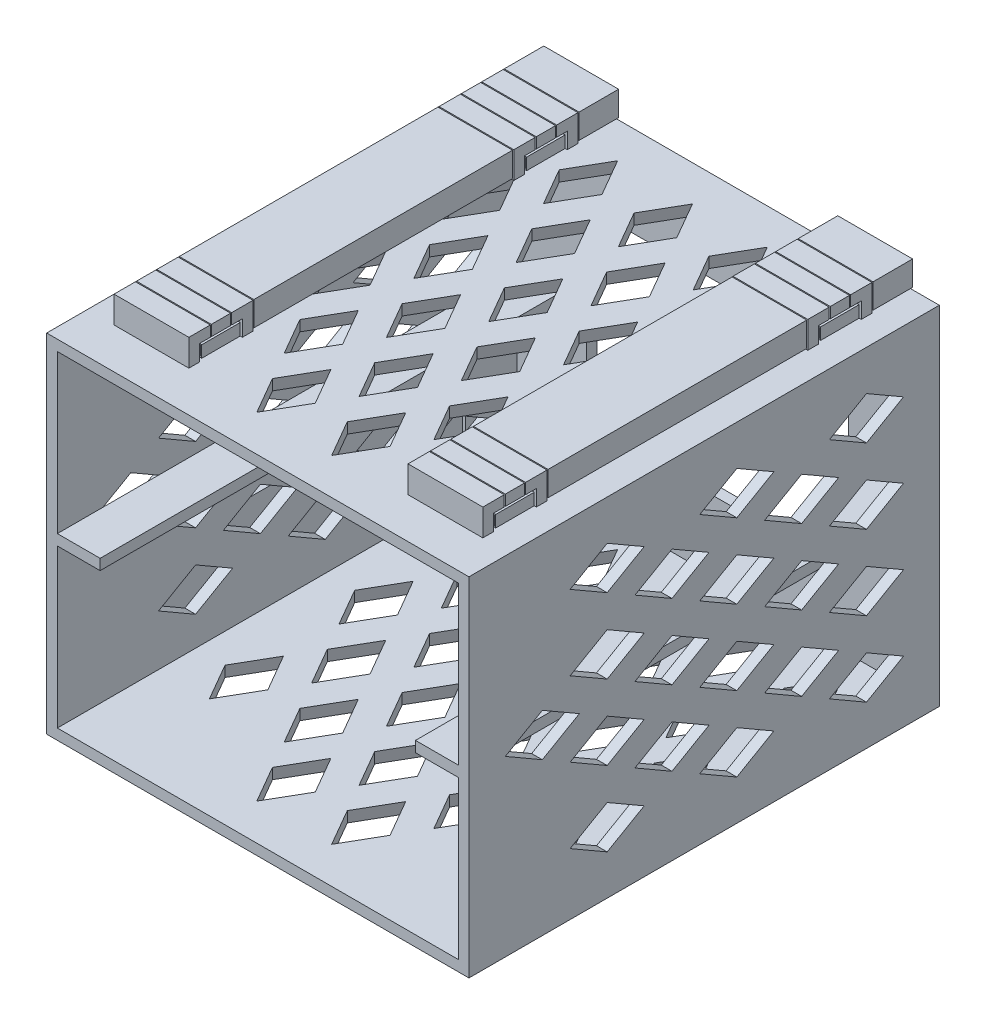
SolidWorks part; units mm, degrees
ref_plane "Alzado" through (0, 0, 0) normal (0, 0, 1) x (1, 0, 0)
ref_plane "Planta" through (0, 0, 0) normal (0, 1, 0) x (1, 0, 0)
ref_plane "Vista lateral" through (0, 0, 0) normal (1, 0, 0) x (0, 0, -1)
sketch "Croquis1" plane through (0, 0, 0) normal (0, 0, -1) x (-1, 0, 0)
  line L1 (-39.5, 32.5) -> (39.5, 32.5)
  line L2 (-39.5, 32.5) -> (-39.5, -32.5)
  line L3 (-39.5, -32.5) -> (39.5, -32.5)
  line L4 (39.5, 32.5) -> (39.5, -32.5)
  line L7 (-24.5, 17.5) -> (24.5, 17.5)
  line L8 (-24.5, 17.5) -> (-24.5, -17.5)
  line L9 (-24.5, -17.5) -> (24.5, -17.5)
  line L10 (24.5, 17.5) -> (24.5, -17.5)
extrude "Fondo" add sketch "Croquis1" against normal blind 2 separate body
sketch "Croquis3" plane through (0, 0, 2) normal (0, 0, 1) x (1, 0, 0)
  line L1 (-39.5, 32.5) -> (39.5, 32.5)
  line L2 (-39.5, 32.5) -> (-39.5, -32.5)
  line L3 (-39.5, -32.5) -> (39.5, -32.5)
  line L4 (39.5, 32.5) -> (39.5, -32.5)
  line L6 (-37.5, 30.5) -> (-37.5, -30.5)
  line L7 (-37.5, 30.5) -> (37.5, 30.5)
  line L8 (37.5, 30.5) -> (37.5, -30.5)
  line L9 (-37.5, -30.5) -> (37.5, -30.5)
extrude "Estructura" add sketch "Croquis3" along normal blind 86
sketch "Croquis5" plane through (-39.5, 0, 0) normal (-1, 0, 0) x (0, 0, 1)
  line L0 (13.628, 25) -> (20.556, 21)
  line L1 (20.556, 21) -> (13.628, 17)
  line L2 (13.628, 17) -> (6.7, 21)
  line L3 (6.7, 21) -> (13.628, 25)
  line L4 (0, -32.5) -> (0, 32.5) construction
  line L5 (88, 32.5) -> (0, 32.5) construction
  line L6 (13.628, 11) -> (20.556, 7)
  line L7 (6.7, 7) -> (13.628, 11)
  line L8 (13.628, 3) -> (6.7, 7)
  line L9 (20.556, 7) -> (13.628, 3)
  line L10 (13.628, -3) -> (20.556, -7)
  line L11 (6.7, -7) -> (13.628, -3)
  line L12 (13.628, -11) -> (6.7, -7)
  line L13 (20.556, -7) -> (13.628, -11)
  line L14 (13.628, -17) -> (20.556, -21)
  line L15 (6.7, -21) -> (13.628, -17)
  line L16 (13.628, -25) -> (6.7, -21)
  line L17 (20.556, -21) -> (13.628, -25)
  line L18 (37.884, 25) -> (44.812, 21)
  line L19 (44.812, 21) -> (37.884, 17)
  line L20 (37.884, 17) -> (30.956, 21)
  line L21 (30.956, 21) -> (37.884, 25)
  line L22 (44.812, 7) -> (37.884, 3)
  line L23 (37.884, 11) -> (44.812, 7)
  line L24 (30.956, 7) -> (37.884, 11)
  line L25 (37.884, 3) -> (30.956, 7)
  line L26 (44.812, -7) -> (37.884, -11)
  line L27 (37.884, -3) -> (44.812, -7)
  line L28 (30.956, -7) -> (37.884, -3)
  line L29 (37.884, -11) -> (30.956, -7)
  line L30 (37.884, -17) -> (44.812, -21)
  line L31 (44.812, -21) -> (37.884, -25)
  line L32 (37.884, -25) -> (30.956, -21)
  line L33 (30.956, -21) -> (37.884, -17)
  line L34 (62.14, 25) -> (69.068, 21)
  line L35 (69.068, 21) -> (62.14, 17)
  line L36 (62.14, 17) -> (55.212, 21)
  line L37 (55.212, 21) -> (62.14, 25)
  line L38 (69.068, 7) -> (62.14, 3)
  line L39 (62.14, 11) -> (69.068, 7)
  line L40 (55.212, 7) -> (62.14, 11)
  line L41 (62.14, 3) -> (55.212, 7)
  line L42 (69.068, -7) -> (62.14, -11)
  line L43 (62.14, -3) -> (69.068, -7)
  line L44 (55.212, -7) -> (62.14, -3)
  line L45 (62.14, -11) -> (55.212, -7)
  line L46 (62.14, -17) -> (69.068, -21)
  line L47 (69.068, -21) -> (62.14, -25)
  line L48 (62.14, -25) -> (55.212, -21)
  line L49 (55.212, -21) -> (62.14, -17)
  line L66 (50.012, 18) -> (56.94, 14)
  line L67 (56.94, 14) -> (50.012, 10)
  line L68 (50.012, 10) -> (43.084, 14)
  line L69 (43.084, 14) -> (50.012, 18)
  line L70 (50.012, 4) -> (56.94, 0)
  line L71 (43.084, 0) -> (50.012, 4)
  line L72 (50.012, -4) -> (43.084, 0)
  line L73 (56.94, -14) -> (50.012, -18)
  line L74 (50.012, -10) -> (56.94, -14)
  line L75 (43.084, -14) -> (50.012, -10)
  line L76 (18.828, 14) -> (25.756, 18)
  line L77 (67.34, 14) -> (74.268, 18) construction
  line L78 (67.34, -14) -> (74.268, -10) construction
  line L79 (74.268, -18) -> (67.34, -14) construction
  line L80 (25.756, 4) -> (32.684, 0)
  line L81 (18.828, 0) -> (25.756, 4)
  line L82 (25.756, -4) -> (18.828, 0)
  line L83 (32.684, 0) -> (25.756, -4)
  line L84 (25.756, -18) -> (18.828, -14)
  line L85 (32.684, -14) -> (25.756, -18)
  line L86 (56.94, 0) -> (50.012, -4)
  line L87 (50.012, -18) -> (43.084, -14)
  line L88 (32.684, 14) -> (25.756, 10)
  line L89 (25.756, 10) -> (18.828, 14)
  line L90 (25.756, 18) -> (32.684, 14)
  line L91 (74.268, 18) -> (81.196, 14) construction
  line L92 (81.196, 14) -> (74.268, 10) construction
  line L93 (74.268, 10) -> (67.34, 14) construction
  line L94 (81.196, 0) -> (74.268, -4)
  line L95 (74.268, 4) -> (81.196, 0)
  line L96 (67.34, 0) -> (74.268, 4)
  line L97 (74.268, -4) -> (67.34, 0)
  line L98 (81.196, -14) -> (74.268, -18) construction
  line L99 (74.268, -10) -> (81.196, -14) construction
  line L100 (25.756, -10) -> (32.684, -14)
  line L101 (18.828, -14) -> (25.756, -10)
  line L102 (88, 32.5) -> (0, 32.5) construction
  line L103 (86.396, 25) -> (93.324, 21)
  line L104 (93.324, 21) -> (86.396, 17)
  line L105 (86.396, 17) -> (79.468, 21)
  line L106 (79.468, 21) -> (86.396, 25)
  line L107 (93.324, 7) -> (86.396, 3)
  line L108 (86.396, 11) -> (93.324, 7)
  line L109 (79.468, 7) -> (86.396, 11)
  line L110 (86.396, 3) -> (79.468, 7)
  line L111 (93.324, -7) -> (86.396, -11)
  line L112 (86.396, -3) -> (93.324, -7)
  line L113 (79.468, -7) -> (86.396, -3)
  line L114 (86.396, -11) -> (79.468, -7)
  line L115 (86.396, -17) -> (93.324, -21)
  line L116 (93.324, -21) -> (86.396, -25)
  line L117 (86.396, -25) -> (79.468, -21)
  line L118 (79.468, -21) -> (86.396, -17)
  dimension "D1" = 7.9998
  dimension "D2" = 7.9998
  dimension "D3" = 6.7
  dimension "D4" = 7.5
  dimension "D5" = 8
  dimension "D7" = 13.856
  dimension "D9" = 24.256
  dimension "D10" = 14.5
  dimension "D11" = 24.256
  dimension "D6" = 4
  dimension "D8" = 4
extrude "RombosHor" cut sketch "Croquis5" against normal up to surface (79 mm away)
sketch "Croquis9" plane through (0, 32.5, 0) normal (0, 1, 0) x (1, 0, 0)
  line L0 (28, -6.6872) -> (24, -13.6154)
  line L1 (28, -6.6872) -> (32, -13.6154)
  line L2 (24, -13.6154) -> (28, -20.5436)
  line L3 (32, -13.6154) -> (28, -20.5436)
  line L4 (14, -6.6872) -> (10, -13.6154)
  line L5 (14, -6.6872) -> (18, -13.6154)
  line L6 (18, -13.6154) -> (14, -20.5436)
  line L7 (10, -13.6154) -> (14, -20.5436)
  line L8 (0, -6.6872) -> (-4, -13.6154)
  line L9 (0, -6.6872) -> (4, -13.6154)
  line L10 (4, -13.6154) -> (0, -20.5436)
  line L11 (-4, -13.6154) -> (0, -20.5436)
  line L12 (-14, -6.6872) -> (-18, -13.6154)
  line L13 (-14, -6.6872) -> (-10, -13.6154)
  line L14 (-10, -13.6154) -> (-14, -20.5436)
  line L15 (-18, -13.6154) -> (-14, -20.5436)
  line L16 (-28, -6.6872) -> (-32, -13.6154)
  line L17 (-28, -6.6872) -> (-24, -13.6154)
  line L18 (-24, -13.6154) -> (-28, -20.5436)
  line L19 (-32, -13.6154) -> (-28, -20.5436)
  line L20 (14, -30.9436) -> (10, -37.8718)
  line L21 (14, -30.9436) -> (18, -37.8718)
  line L22 (18, -37.8718) -> (14, -44.8)
  line L23 (10, -37.8718) -> (14, -44.8)
  line L24 (0, -30.9436) -> (-4, -37.8718)
  line L25 (0, -30.9436) -> (4, -37.8718)
  line L26 (4, -37.8718) -> (0, -44.8)
  line L27 (-4, -37.8718) -> (0, -44.8)
  line L28 (-14, -30.9436) -> (-18, -37.8718)
  line L29 (-14, -30.9436) -> (-10, -37.8718)
  line L30 (-10, -37.8718) -> (-14, -44.8)
  line L31 (-18, -37.8718) -> (-14, -44.8)
  line L32 (-28, -30.9436) -> (-32, -37.8718)
  line L33 (-28, -30.9436) -> (-24, -37.8718)
  line L34 (-24, -37.8718) -> (-28, -44.8)
  line L35 (-32, -37.8718) -> (-28, -44.8)
  line L36 (14, -55.2) -> (10, -62.1282)
  line L37 (14, -55.2) -> (18, -62.1282)
  line L38 (18, -62.1282) -> (14, -69.0564)
  line L39 (10, -62.1282) -> (14, -69.0564)
  line L40 (0, -55.2) -> (-4, -62.1282)
  line L41 (0, -55.2) -> (4, -62.1282)
  line L42 (4, -62.1282) -> (0, -69.0564)
  line L43 (-4, -62.1282) -> (0, -69.0564)
  line L44 (-14, -55.2) -> (-18, -62.1282)
  line L45 (-14, -55.2) -> (-10, -62.1282)
  line L46 (-10, -62.1282) -> (-14, -69.0564)
  line L47 (-18, -62.1282) -> (-14, -69.0564)
  line L48 (-28, -55.2) -> (-32, -62.1282)
  line L49 (-28, -55.2) -> (-24, -62.1282)
  line L50 (-24, -62.1282) -> (-28, -69.0564)
  line L51 (-32, -62.1282) -> (-28, -69.0564)
  line L68 (28, -30.9436) -> (24, -37.8718)
  line L69 (28, -30.9436) -> (32, -37.8718)
  line L70 (32, -37.8718) -> (28, -44.8)
  line L71 (24, -37.8718) -> (28, -44.8)
  line L72 (28, -55.2) -> (24, -62.1282)
  line L73 (28, -55.2) -> (32, -62.1282)
  line L74 (32, -62.1282) -> (28, -69.0564)
  line L75 (24, -62.1282) -> (28, -69.0564)
  line L80 (28, -6.6872) -> (14, -6.6872) construction
  line L81 (28, -6.6872) -> (28, -30.9436) construction
  line L83 (39.5, -88) -> (39.5, 0) construction
  line L87 (-39.5, 0) -> (39.5, 0) construction
  line L88 (17, -50.0018) -> (21, -56.93)
  line L89 (7, -67.33) -> (11, -74.2582)
  line L90 (-7, -67.33) -> (-11, -74.2582)
  line L91 (-7, -67.33) -> (-3, -74.2582)
  line L92 (-3, -74.2582) -> (-7, -81.1864)
  line L93 (-21, -67.33) -> (-25, -74.2582) construction
  line L94 (-21, -67.33) -> (-17, -74.2582) construction
  line L95 (-25, -74.2582) -> (-21, -81.1864) construction
  line L96 (21, -67.33) -> (25, -74.2582) construction
  line L97 (25, -74.2582) -> (21, -81.1864) construction
  line L98 (17, -74.2582) -> (21, -81.1864) construction
  line L99 (7, -18.8172) -> (3, -25.7454)
  line L100 (17, -25.7454) -> (21, -32.6736)
  line L101 (21, -18.8172) -> (25, -25.7454)
  line L102 (-7, -43.0736) -> (-11, -50.0018)
  line L103 (-3, -50.0018) -> (-7, -56.93)
  line L104 (-21, -43.0736) -> (-25, -50.0018)
  line L105 (-21, -43.0736) -> (-17, -50.0018)
  line L106 (-3, -25.7454) -> (-7, -32.6736)
  line L107 (-11, -25.7454) -> (-7, -32.6736)
  line L108 (-21, -18.8172) -> (-17, -25.7454)
  line L109 (-21, -18.8172) -> (-25, -25.7454)
  line L110 (-25, -25.7454) -> (-21, -32.6736)
  line L111 (21, -43.0736) -> (17, -50.0018)
  line L112 (11, -25.7454) -> (7, -32.6736)
  line L113 (7, -18.8172) -> (11, -25.7454)
  line L114 (7, -67.33) -> (3, -74.2582)
  line L115 (11, -74.2582) -> (7, -81.1864)
  line L116 (3, -74.2582) -> (7, -81.1864)
  line L117 (-11, -74.2582) -> (-7, -81.1864)
  line L118 (-17, -74.2582) -> (-21, -81.1864) construction
  line L119 (21, -67.33) -> (17, -74.2582) construction
  line L120 (7, -43.0736) -> (3, -50.0018)
  line L121 (7, -43.0736) -> (11, -50.0018)
  line L122 (11, -50.0018) -> (7, -56.93)
  line L123 (3, -50.0018) -> (7, -56.93)
  line L124 (21, -43.0736) -> (25, -50.0018)
  line L125 (25, -50.0018) -> (21, -56.93)
  line L126 (21, -18.8172) -> (17, -25.7454)
  line L127 (-7, -43.0736) -> (-3, -50.0018)
  line L128 (-11, -50.0018) -> (-7, -56.93)
  line L129 (-17, -50.0018) -> (-21, -56.93)
  line L130 (-25, -50.0018) -> (-21, -56.93)
  line L131 (-7, -18.8172) -> (-11, -25.7454)
  line L132 (-7, -18.8172) -> (-3, -25.7454)
  line L133 (-17, -25.7454) -> (-21, -32.6736)
  line L134 (3, -25.7454) -> (7, -32.6736)
  line L135 (25, -25.7454) -> (21, -32.6736)
  line L136 (18, -86.3846) -> (14, -93.3128)
  line L137 (10, -86.3846) -> (14, -93.3128)
  line L138 (4, -86.3846) -> (0, -93.3128)
  line L139 (-4, -86.3846) -> (0, -93.3128)
  line L140 (-10, -86.3846) -> (-14, -93.3128)
  line L141 (-18, -86.3846) -> (-14, -93.3128)
  line L142 (-24, -86.3846) -> (-28, -93.3128)
  line L143 (-32, -86.3846) -> (-28, -93.3128)
  line L144 (32, -86.3846) -> (28, -93.3128)
  line L145 (24, -86.3846) -> (28, -93.3128)
  line L146 (14, -79.4564) -> (10, -86.3846)
  line L147 (14, -79.4564) -> (18, -86.3846)
  line L148 (0, -79.4564) -> (-4, -86.3846)
  line L149 (0, -79.4564) -> (4, -86.3846)
  line L150 (-14, -79.4564) -> (-18, -86.3846)
  line L151 (-14, -79.4564) -> (-10, -86.3846)
  line L152 (-28, -79.4564) -> (-32, -86.3846)
  line L153 (-28, -79.4564) -> (-24, -86.3846)
  line L154 (28, -79.4564) -> (24, -86.3846)
  line L155 (28, -79.4564) -> (32, -86.3846)
  dimension "D1" = 8
  dimension "D2" = 8
  dimension "D3" = 8
  dimension "D4" = 13.8564
  dimension "D7" = 14
  dimension "D8" = 24.2564
  dimension "D9" = 6.6872
  dimension "D10" = 7.5
  dimension "D5" = 5
  dimension "D6" = 4
extrude "RombosVert" cut sketch "Croquis9" against normal up to surface (65 mm away)
sketch "Croquis8" plane through (0, 0, 2) normal (0, 0, 1) x (1, 0, 0)
  line L0 (-37.5, -30.5) -> (37.5, -30.5) construction
  line L1 (-29.5, -1) -> (-37.5, -1)
  line L2 (-29.5, -1) -> (-29.5, 1)
  line L3 (-29.5, 1) -> (-37.5, 1)
  line L4 (-37.5, -1) -> (-37.5, 1)
  line L5 (29.5, 1) -> (37.5, 1)
  line L6 (29.5, 1) -> (29.5, -1)
  line L7 (29.5, -1) -> (37.5, -1)
  line L8 (37.5, 1) -> (37.5, -1)
  dimension "D1" = 8
  dimension "D2" = 2
  dimension "D3" = 29.5
extrude "Guias" add sketch "Croquis8" along normal blind 86
sketch "Croquis10" plane through (39.5, 0, 0) normal (1, 0, 0) x (0, 0, -1)
  line L0 (-88, 32.5) -> (0, 32.5) construction
  line L1 (-12.104, -27.5) -> (-12.104, -13.5)
  line L2 (-15.104, -13.5) -> (-12.104, -13.5)
  line L3 (-15.104, -27.5) -> (-15.104, -13.5)
  line L4 (-15.104, -27.5) -> (-12.104, -27.5)
  line L5 (-88, 0) -> (0, 0) construction
  line L6 (-75.896, 27.5) -> (-75.896, 13.5)
  line L7 (-72.896, 13.5) -> (-75.896, 13.5)
  line L8 (-72.896, 27.5) -> (-72.896, 13.5)
  line L9 (0, 32.5) -> (0, -32.5) construction
  line L11 (-44, -32.5) -> (-44, 32.5) construction
  line L12 (-15.104, 27.5) -> (-12.104, 27.5)
  line L13 (-15.104, 27.5) -> (-15.104, 13.5)
  line L14 (-15.104, 13.5) -> (-12.104, 13.5)
  line L15 (-12.104, 27.5) -> (-12.104, 13.5)
  line L16 (-72.896, 27.5) -> (-75.896, 27.5)
  line L17 (-72.896, -27.5) -> (-75.896, -27.5)
  line L18 (-72.896, -27.5) -> (-72.896, -13.5)
  line L19 (-72.896, -13.5) -> (-75.896, -13.5)
  line L20 (-75.896, -27.5) -> (-75.896, -13.5)
  line L21 (-88, -32.5) -> (0, -32.5) construction
  dimension "D1" = 44
  dimension "D2" = 32.5
  dimension "D6" = 3
  dimension "D7" = 14
  dimension "D8" = 5
  dimension "D9" = 12.104
extrude "AncDer01" [suppressed] add sketch "Croquis10" along normal blind 2.5
sketch "Croquis11" [suppressed] plane through (42, 0, 0) normal (1, 0, 0) x (0, 0, -1)
  line L0 (-15.104, 13.5) -> (-12.104, 13.5) construction
  line L1 (0, 32.5) -> (0, -32.5) construction
  line L2 (-15.104, 27.5) -> (-15.104, 24.1478) construction
  line L3 (-17.104, 27.5) -> (-10.104, 27.5)
  line L4 (-17.104, 27.5) -> (-17.104, 13.5)
  line L5 (-44, 32.5) -> (-44, -32.5) construction
  line L6 (-12.104, 27.5) -> (-15.104, 27.5) construction
  line L7 (-10.104, -27.5) -> (-10.104, -13.5)
  line L8 (-17.104, 13.5) -> (-10.104, 13.5)
  line L9 (-17.104, -13.5) -> (-10.104, -13.5)
  line L10 (-88, 0) -> (0, 0) construction
  line L11 (-10.104, 27.5) -> (-10.104, 13.5)
  line L12 (-17.104, -27.5) -> (-17.104, -13.5)
  line L13 (-17.104, -27.5) -> (-10.104, -27.5)
  line L14 (-70.896, -27.5) -> (-77.896, -27.5)
  line L15 (-70.896, -27.5) -> (-70.896, -13.5)
  line L16 (-77.896, 27.5) -> (-77.896, 13.5)
  line L17 (-70.896, -13.5) -> (-77.896, -13.5)
  line L18 (-70.896, 13.5) -> (-77.896, 13.5)
  line L19 (-77.896, -27.5) -> (-77.896, -13.5)
  line L20 (-70.896, 27.5) -> (-70.896, 13.5)
  line L21 (-70.896, 27.5) -> (-77.896, 27.5)
  dimension "D1" = 44
  dimension "D2" = 88
  dimension "D3" = 7
  dimension "D4" = 2
extrude "AncDer02" [suppressed] add sketch "Croquis11" along normal blind 1.8
sketch "Croquis12" plane through (0, 32.5, 0) normal (0, 1, 0) x (1, 0, 0)
  line L1 (20.5, -9.604) -> (20.5, -7.604)
  line L2 (34.5, -7.604) -> (20.5, -7.604)
  line L3 (34.5, -9.604) -> (34.5, -7.604)
  line L4 (34.5, -9.604) -> (20.5, -9.604)
  line L5 (20.5, -19.604) -> (20.5, -17.604)
  line L6 (34.5, -17.604) -> (20.5, -17.604)
  line L7 (34.5, -19.604) -> (34.5, -17.604)
  line L8 (34.5, -19.604) -> (20.5, -19.604)
  line L10 (39.5, -44) -> (-39.5, -44) construction
  line L11 (-20.5, -78.396) -> (-20.5, -80.396)
  line L12 (-34.5, -80.396) -> (-20.5, -80.396)
  line L13 (0, -88) -> (0, 0) construction
  line L14 (-34.5, -78.396) -> (-34.5, -80.396)
  line L15 (-34.5, -78.396) -> (-20.5, -78.396)
  line L16 (-20.5, -68.396) -> (-20.5, -70.396)
  line L17 (-34.5, -70.396) -> (-20.5, -70.396)
  line L18 (-34.5, -68.396) -> (-34.5, -70.396)
  line L19 (-34.5, -68.396) -> (-20.5, -68.396)
  line L20 (34.5, -68.396) -> (20.5, -68.396)
  line L21 (-34.5, -19.604) -> (-20.5, -19.604)
  line L22 (-34.5, -19.604) -> (-34.5, -17.604)
  line L23 (-34.5, -17.604) -> (-20.5, -17.604)
  line L24 (-20.5, -19.604) -> (-20.5, -17.604)
  line L25 (-34.5, -9.604) -> (-20.5, -9.604)
  line L26 (-34.5, -9.604) -> (-34.5, -7.604)
  line L27 (-34.5, -7.604) -> (-20.5, -7.604)
  line L28 (-20.5, -9.604) -> (-20.5, -7.604)
  line L29 (34.5, -68.396) -> (34.5, -70.396)
  line L30 (34.5, -70.396) -> (20.5, -70.396)
  line L31 (20.5, -68.396) -> (20.5, -70.396)
  line L32 (34.5, -78.396) -> (20.5, -78.396)
  line L33 (34.5, -78.396) -> (34.5, -80.396)
  line L34 (34.5, -80.396) -> (20.5, -80.396)
  line L35 (20.5, -78.396) -> (20.5, -80.396)
  line L38 (-39.5, 0) -> (39.5, 0) construction
  line L39 (-39.5, -88) -> (-39.5, 0) construction
  dimension "D9" = 88
  dimension "D10" = 44
  dimension "D11" = 2
  dimension "D12" = 2
  dimension "D13" = 14
  dimension "D14" = 14
  dimension "D15" = 5
  dimension "D16" = 5
  dimension "D17" = 7.604
  dimension "D18" = 8
extrude "AncSup01" add sketch "Croquis12" along normal blind 3
sketch "Croquis13" plane through (0, 35.5, 0) normal (0, 1, 0) x (1, 0, 0)
  line L0 (39.5, -44) -> (-39.5, -44) construction
  line L2 (-39.5, 0) -> (39.5, 0) construction
  line L3 (-20.5, -9.604) -> (-20.5, -7.604) construction
  line L4 (-34.5, -7.604) -> (-20.5, -7.604)
  line L5 (-34.5, -7.604) -> (-34.5, -11.604)
  line L6 (-34.5, -11.604) -> (-20.5, -11.604)
  line L7 (-20.5, -7.604) -> (-20.5, -11.604)
  line L8 (-27.4575, -19.604) -> (-21.4543, -19.604) construction
  line L10 (-34.5, -19.604) -> (-20.5, -19.604)
  line L11 (0, 0) -> (0, -88) construction
  line L13 (-34.5, -19.604) -> (-34.5, -15.604)
  line L14 (-34.5, -15.604) -> (-20.5, -15.604)
  line L15 (-20.5, -19.604) -> (-20.5, -15.604)
  line L16 (-20.5, -19.604) -> (-20.5, -17.604) construction
  line L17 (20.5, -19.604) -> (20.5, -15.604)
  line L18 (34.5, -15.604) -> (20.5, -15.604)
  line L19 (34.5, -19.604) -> (34.5, -15.604)
  line L20 (34.5, -19.604) -> (20.5, -19.604)
  line L21 (20.5, -7.604) -> (20.5, -11.604)
  line L22 (34.5, -11.604) -> (20.5, -11.604)
  line L23 (34.5, -7.604) -> (34.5, -11.604)
  line L24 (34.5, -7.604) -> (20.5, -7.604)
  line L25 (34.5, -80.396) -> (20.5, -80.396)
  line L26 (34.5, -80.396) -> (34.5, -76.396)
  line L27 (34.5, -76.396) -> (20.5, -76.396)
  line L28 (20.5, -80.396) -> (20.5, -76.396)
  line L29 (34.5, -68.396) -> (20.5, -68.396)
  line L30 (34.5, -68.396) -> (34.5, -72.396)
  line L31 (34.5, -72.396) -> (20.5, -72.396)
  line L32 (20.5, -68.396) -> (20.5, -72.396)
  line L33 (-20.5, -68.396) -> (-20.5, -72.396)
  line L34 (-34.5, -72.396) -> (-20.5, -72.396)
  line L35 (-34.5, -68.396) -> (-34.5, -72.396)
  line L36 (-34.5, -68.396) -> (-20.5, -68.396)
  line L37 (-20.5, -80.396) -> (-20.5, -76.396)
  line L38 (-34.5, -76.396) -> (-20.5, -76.396)
  line L39 (-34.5, -80.396) -> (-34.5, -76.396)
  line L40 (-34.5, -80.396) -> (-20.5, -80.396)
  dimension "D1" = 44
  dimension "D2" = 88
  dimension "D3" = 4
  dimension "D4" = 4
extrude "AncSup02" add sketch "Croquis13" along normal blind 2
sketch "Croquis52" plane through (-39.5, 0, 0) normal (-1, 0, 0) x (0, 0, 1)
  line L0 (0, -32.5) -> (0, 32.5) construction
  line L1 (88, 32.5) -> (0, 32.5) construction
  line L2 (9.604, -27.5) -> (7.604, -27.5)
  line L3 (9.604, -27.5) -> (9.604, -13.5)
  line L4 (9.604, -13.5) -> (7.604, -13.5)
  line L5 (7.604, -27.5) -> (7.604, -13.5)
  line L6 (19.604, -27.5) -> (17.604, -27.5)
  line L7 (19.604, -27.5) -> (19.604, -13.5)
  line L8 (19.604, -13.5) -> (17.604, -13.5)
  line L9 (44, 32.5) -> (44, -32.5) construction
  line L10 (17.604, -27.5) -> (17.604, -13.5)
  line L11 (78.396, 27.5) -> (80.396, 27.5)
  line L12 (78.396, 27.5) -> (78.396, 13.5)
  line L13 (78.396, 13.5) -> (80.396, 13.5)
  line L14 (80.396, 27.5) -> (80.396, 13.5)
  line L15 (68.396, 27.5) -> (70.396, 27.5)
  line L16 (88, 0) -> (0, 0) construction
  line L17 (68.396, 27.5) -> (68.396, 13.5)
  line L18 (68.396, 13.5) -> (70.396, 13.5)
  line L19 (70.396, 27.5) -> (70.396, 13.5)
  line L20 (70.396, -27.5) -> (70.396, -13.5)
  line L21 (68.396, -13.5) -> (70.396, -13.5)
  line L22 (68.396, -27.5) -> (68.396, -13.5)
  line L23 (68.396, -27.5) -> (70.396, -27.5)
  line L24 (80.396, -27.5) -> (80.396, -13.5)
  line L25 (78.396, -13.5) -> (80.396, -13.5)
  line L26 (78.396, -27.5) -> (78.396, -13.5)
  line L27 (78.396, -27.5) -> (80.396, -27.5)
  line L32 (17.604, 27.5) -> (17.604, 13.5)
  line L33 (19.604, 13.5) -> (17.604, 13.5)
  line L34 (19.604, 27.5) -> (19.604, 13.5)
  line L35 (19.604, 27.5) -> (17.604, 27.5)
  line L36 (7.604, 27.5) -> (7.604, 13.5)
  line L37 (9.604, 13.5) -> (7.604, 13.5)
  line L38 (9.604, 27.5) -> (9.604, 13.5)
  line L39 (9.604, 27.5) -> (7.604, 27.5)
  dimension "D1" = 44
  dimension "D2" = 88
  dimension "D3" = 2
  dimension "D4" = 2
  dimension "D5" = 8
  dimension "D6" = 14
  dimension "D7" = 14
  dimension "D8" = 7.604
  dimension "D9" = 5
  dimension "D10" = 5
extrude "AncIzq01" add sketch "Croquis52" along normal blind 3
sketch "Croquis53" plane through (-42.5, 0, 0) normal (-1, 0, 0) x (0, 0, 1)
  line L0 (44, 32.5) -> (44, -32.5) construction
  line L1 (0, -32.5) -> (0, 32.5) construction
  line L2 (7.604, 13.5) -> (9.604, 13.5) construction
  line L3 (7.604, 27.5) -> (11.604, 27.5)
  line L4 (7.604, 27.5) -> (7.604, 13.5)
  line L5 (7.604, 13.5) -> (11.604, 13.5)
  line L6 (11.604, 27.5) -> (11.604, 13.5)
  line L7 (17.604, 13.5) -> (19.604, 13.5) construction
  line L8 (19.604, 27.5) -> (15.604, 27.5)
  line L10 (19.604, 27.5) -> (19.604, 13.5)
  line L12 (88, 0) -> (0, 0) construction
  line L13 (19.604, 13.5) -> (15.604, 13.5)
  line L14 (15.604, 27.5) -> (15.604, 13.5)
  line L15 (15.604, -27.5) -> (15.604, -13.5)
  line L16 (19.604, -13.5) -> (15.604, -13.5)
  line L17 (19.604, -27.5) -> (19.604, -13.5)
  line L18 (19.604, -27.5) -> (15.604, -27.5)
  line L19 (11.604, -27.5) -> (11.604, -13.5)
  line L20 (7.604, -13.5) -> (11.604, -13.5)
  line L21 (7.604, -27.5) -> (7.604, -13.5)
  line L22 (7.604, -27.5) -> (11.604, -27.5)
  line L23 (80.396, -27.5) -> (76.396, -27.5)
  line L24 (80.396, -27.5) -> (80.396, -13.5)
  line L25 (80.396, -13.5) -> (76.396, -13.5)
  line L26 (76.396, -27.5) -> (76.396, -13.5)
  line L27 (68.396, -27.5) -> (72.396, -27.5)
  line L28 (68.396, -27.5) -> (68.396, -13.5)
  line L29 (68.396, -13.5) -> (72.396, -13.5)
  line L30 (72.396, -27.5) -> (72.396, -13.5)
  line L31 (72.396, 27.5) -> (72.396, 13.5)
  line L32 (68.396, 13.5) -> (72.396, 13.5)
  line L33 (68.396, 27.5) -> (68.396, 13.5)
  line L34 (68.396, 27.5) -> (72.396, 27.5)
  line L35 (76.396, 27.5) -> (76.396, 13.5)
  line L36 (80.396, 13.5) -> (76.396, 13.5)
  line L37 (80.396, 27.5) -> (80.396, 13.5)
  line L38 (80.396, 27.5) -> (76.396, 27.5)
  dimension "D1" = 44
  dimension "D2" = 88
  dimension "D3" = 4
  dimension "D4" = 4
extrude "AncIzq02" add sketch "Croquis53" along normal blind 2
sketch "Croquis54" plane through (0, -32.5, 0) normal (0, -1, 0) x (1, 0, 0)
  line L0 (0, 88) -> (0, 0) construction
  line L1 (-34.5, 15.104) -> (-20.5, 15.104)
  line L2 (-34.5, 15.104) -> (-34.5, 12.104)
  line L3 (-34.5, 12.104) -> (-20.5, 12.104)
  line L4 (-20.5, 15.104) -> (-20.5, 12.104)
  line L5 (-39.5, 88) -> (39.5, 88) construction
  line L6 (-39.5, 44) -> (39.5, 44) construction
  line L7 (-39.5, 88) -> (-39.5, 0) construction
  line L8 (39.5, 88) -> (39.5, 0) construction
  line L9 (39.5, 0) -> (-39.5, 0) construction
  line L10 (20.5, 15.104) -> (20.5, 12.104)
  line L11 (34.5, 12.104) -> (20.5, 12.104)
  line L12 (34.5, 15.104) -> (34.5, 12.104)
  line L13 (34.5, 15.104) -> (20.5, 15.104)
  line L14 (34.5, 72.896) -> (20.5, 72.896)
  line L15 (34.5, 72.896) -> (34.5, 75.896)
  line L16 (34.5, 75.896) -> (20.5, 75.896)
  line L17 (20.5, 72.896) -> (20.5, 75.896)
  line L18 (-20.5, 72.896) -> (-20.5, 75.896)
  line L19 (-34.5, 75.896) -> (-20.5, 75.896)
  line L20 (-34.5, 72.896) -> (-34.5, 75.896)
  line L21 (-34.5, 72.896) -> (-20.5, 72.896)
  dimension "D1" = 3
  dimension "D2" = 14
  dimension "D3" = 5
  dimension "D4" = 12.104
extrude "AncInf01" [suppressed] add sketch "Croquis54" along normal blind 2.5
sketch "Croquis55" [suppressed] plane through (0, -35, 0) normal (0, -1, 0) x (1, 0, 0)
  line L1 (-34.5, 77.896) -> (-20.5, 77.896)
  line L2 (-34.5, 77.896) -> (-34.5, 70.896)
  line L3 (-34.5, 70.896) -> (-20.5, 70.896)
  line L4 (-20.5, 77.896) -> (-20.5, 70.896)
  line L6 (-20.5, 72.896) -> (-20.5, 75.896) construction
  line L7 (-34.5, 75.896) -> (-34.5, 72.896) construction
  line L8 (-34.5, 72.896) -> (-20.5, 72.896) construction
  line L9 (-39.5, 44) -> (39.5, 44) construction
  line L10 (-39.5, 88) -> (-39.5, 0) construction
  line L11 (39.5, 88) -> (39.5, 0) construction
  line L12 (0, 88) -> (0, 0) construction
  line L13 (-39.5, 88) -> (39.5, 88) construction
  line L14 (20.5, 77.896) -> (20.5, 70.896)
  line L15 (34.5, 70.896) -> (20.5, 70.896)
  line L16 (34.5, 77.896) -> (34.5, 70.896)
  line L17 (34.5, 77.896) -> (20.5, 77.896)
  line L18 (34.5, 10.104) -> (20.5, 10.104)
  line L19 (34.5, 10.104) -> (34.5, 17.104)
  line L20 (34.5, 17.104) -> (20.5, 17.104)
  line L21 (20.5, 10.104) -> (20.5, 17.104)
  line L22 (-20.5, 10.104) -> (-20.5, 17.104)
  line L23 (-34.5, 17.104) -> (-20.5, 17.104)
  line L24 (-34.5, 10.104) -> (-34.5, 17.104)
  line L25 (-34.5, 10.104) -> (-20.5, 10.104)
  dimension "D1" = 7
  dimension "D2" = 2
extrude "AncInf02" [suppressed] add sketch "Croquis55" along normal blind 1.8
sketch "Croquis61" plane through (0, 0, 0) normal (0, 0, -1) x (-1, 0, 0)
  line L1 (20.5, 32.9) -> (34.5, 32.9)
  line L2 (20.5, 32.9) -> (20.5, 37.5)
  line L3 (20.5, 37.5) -> (34.5, 37.5)
  line L4 (34.5, 32.9) -> (34.5, 37.5)
  line L5 (20.7, 33.1) -> (20.7, 37.3)
  line L6 (20.7, 37.3) -> (34.3, 37.3)
  line L7 (34.3, 33.1) -> (34.3, 37.3)
  line L8 (20.7, 33.1) -> (34.3, 33.1)
  line L9 (0, 32.5) -> (0, 17.5) construction
  line L10 (39.5, 32.5) -> (-39.5, 32.5) construction
  line L11 (24.5, 17.5) -> (-24.5, 17.5) construction
  line L12 (-20.7, 33.1) -> (-34.3, 33.1)
  line L13 (-34.3, 33.1) -> (-34.3, 37.3)
  line L14 (-20.7, 37.3) -> (-34.3, 37.3)
  line L15 (-20.7, 33.1) -> (-20.7, 37.3)
  line L16 (-34.5, 32.9) -> (-34.5, 37.5)
  line L17 (-20.5, 37.5) -> (-34.5, 37.5)
  line L18 (-20.5, 32.9) -> (-20.5, 37.5)
  line L19 (-20.5, 32.9) -> (-34.5, 32.9)
  dimension "D1" = 0.2
extrude "EspAncSup01" add sketch "Croquis61" against normal blind 7.404 separate body
ref_plane "PlanoEspAncSup01" through (0, 0, 19.804) normal (0, 0, 1) x (1, 0, 0)
sketch "Croquis57" plane through (0, 0, 19.804) normal (0, 0, 1) x (1, 0, 0)
  line L1 (34.5, 37.5) -> (20.5457, 37.5)
  line L2 (34.5, 37.5) -> (34.5, 32.9)
  line L3 (34.5, 32.9) -> (20.5457, 32.9)
  line L4 (20.5457, 37.5) -> (20.5457, 32.9)
  line L5 (34.3, 37.3) -> (34.3, 33.1)
  line L6 (34.3, 33.1) -> (20.7457, 33.1)
  line L7 (20.7457, 37.3) -> (20.7457, 33.1)
  line L8 (34.3, 37.3) -> (20.7457, 37.3)
  line L9 (0, 32.5) -> (0, 17.5) construction
  line L10 (-24.5, 17.5) -> (24.5, 17.5) construction
  line L11 (-34.3, 37.3) -> (-20.7457, 37.3)
  line L12 (-20.7457, 37.3) -> (-20.7457, 33.1)
  line L13 (-34.3, 33.1) -> (-20.7457, 33.1)
  line L14 (-34.3, 37.3) -> (-34.3, 33.1)
  line L15 (-20.5457, 37.5) -> (-20.5457, 32.9)
  line L16 (-34.5, 32.9) -> (-20.5457, 32.9)
  line L17 (-34.5, 37.5) -> (-34.5, 32.9)
  line L18 (-34.5, 37.5) -> (-20.5457, 37.5)
  dimension "D1" = 0.2
sketch "Croquis58" plane through (0, 0, 19.804) normal (0, 0, 1) x (1, 0, 0)
  line L0 (33.8, 36.8) -> (33.8, 33.6)
  line L1 (0, 32.5) -> (0, 17.5) construction
  line L2 (-33.6, 36.6) -> (-21.4457, 36.6)
  line L3 (-21.4457, 36.6) -> (-21.4457, 33.8)
  line L4 (-33.6, 33.8) -> (-21.4457, 33.8)
  line L5 (33.8, 33.6) -> (21.2457, 33.6)
  line L6 (21.2457, 36.8) -> (21.2457, 33.6)
  line L7 (33.8, 36.8) -> (21.2457, 36.8)
  line L8 (33.6, 36.6) -> (33.6, 33.8)
  line L9 (33.6, 33.8) -> (21.4457, 33.8)
  line L10 (21.4457, 36.6) -> (21.4457, 33.8)
  line L11 (33.6, 36.6) -> (21.4457, 36.6)
  line L12 (-33.6, 36.6) -> (-33.6, 33.8)
  line L13 (-33.8, 36.8) -> (-21.2457, 36.8)
  line L14 (-21.2457, 36.8) -> (-21.2457, 33.6)
  line L15 (-33.8, 33.6) -> (-21.2457, 33.6)
  line L16 (-33.8, 36.8) -> (-33.8, 33.6)
  dimension "D2" = 0.2
sketch "Croquis59" plane through (0, 0, 19.804) normal (0, 0, 1) x (1, 0, 0)
  line L0 (33.1, 36.1) -> (33.1, 34.3)
  line L1 (0, 32.5) -> (0, 17.5) construction
  line L2 (-32.9, 35.9) -> (-22.1457, 35.9)
  line L3 (-22.1457, 35.9) -> (-22.1457, 34.5)
  line L4 (-32.9, 34.5) -> (-22.1457, 34.5)
  line L5 (33.1, 34.3) -> (21.9457, 34.3)
  line L6 (21.9457, 36.1) -> (21.9457, 34.3)
  line L7 (33.1, 36.1) -> (21.9457, 36.1)
  line L8 (32.9, 35.9) -> (32.9, 34.5)
  line L9 (32.9, 34.5) -> (22.1457, 34.5)
  line L10 (22.1457, 35.9) -> (22.1457, 34.5)
  line L11 (32.9, 35.9) -> (22.1457, 35.9)
  line L12 (-32.9, 35.9) -> (-32.9, 34.5)
  line L13 (-33.1, 36.1) -> (-21.9457, 36.1)
  line L14 (-21.9457, 36.1) -> (-21.9457, 34.3)
  line L15 (-33.1, 34.3) -> (-21.9457, 34.3)
  line L16 (-33.1, 36.1) -> (-33.1, 34.3)
  dimension "D2" = 0.2
extrude "EspAncSup02" add sketch "Croquis57" along normal blind 48.392
extrude "EspAncSup03" add sketch "Croquis58" along normal blind 48.392 separate body
extrude "EspAncSup04" add sketch "Croquis59" along normal blind 48.392 separate body
ref_plane "PlanoEspAncSup02" through (0, 32.9, 0) normal (0, 1, 0) x (1, 0, 0)
sketch "Croquis64" plane through (0, 32.9, 0) normal (0, 1, 0) x (1, 0, 0)
  line L0 (-34.5, -9.604) -> (-29.684, -9.604) construction
  line L1 (-20.5, -17.204) -> (-34.5, -17.204)
  line L2 (-20.5, -17.204) -> (-20.5, -10.004)
  line L3 (-20.5, -10.004) -> (-34.5, -10.004)
  line L4 (-34.5, -17.204) -> (-34.5, -10.004)
  line L5 (-29.6972, -17.604) -> (-34.5, -17.604) construction
  line L6 (-34.5, -7.604) -> (-34.5, -9.604) construction
  line L7 (-39.5, -44) -> (39.5, -44) construction
  line L8 (-39.5, -88) -> (-39.5, 0) construction
  line L9 (39.5, -88) -> (39.5, 0) construction
  line L10 (0, 0) -> (0, -88) construction
  line L11 (39.5, -88) -> (-39.5, -88) construction
  line L12 (34.5, -17.204) -> (34.5, -10.004)
  line L13 (20.5, -10.004) -> (34.5, -10.004)
  line L14 (20.5, -17.204) -> (20.5, -10.004)
  line L15 (20.5, -17.204) -> (34.5, -17.204)
  line L16 (20.5, -70.796) -> (34.5, -70.796)
  line L17 (20.5, -70.796) -> (20.5, -77.996)
  line L18 (20.5, -77.996) -> (34.5, -77.996)
  line L19 (34.5, -70.796) -> (34.5, -77.996)
  line L20 (-34.5, -70.796) -> (-34.5, -77.996)
  line L21 (-20.5, -77.996) -> (-34.5, -77.996)
  line L22 (-20.5, -70.796) -> (-20.5, -77.996)
  line L23 (-20.5, -70.796) -> (-34.5, -70.796)
  dimension "D1" = 0.4
  dimension "D2" = 0.4
  dimension "D3" = 14
extrude "EspAncSup05" add sketch "Croquis64" along normal blind 2.2
sketch "Croquis66" plane through (0, 0, 17.204) normal (0, 0, 1) x (1, 0, 0)
  line L0 (-34.3, 34.9) -> (-34.3, 33.1)
  line L1 (0, 17.5) -> (0, 30.5) construction
  line L2 (-24.5, 17.5) -> (24.5, 17.5) construction
  line L3 (37.5, 30.5) -> (-37.5, 30.5) construction
  line L4 (34.3, 34.9) -> (20.7, 34.9)
  line L5 (-34.3, 33.1) -> (-20.7, 33.1)
  line L6 (-20.7, 34.9) -> (-20.7, 33.1)
  line L7 (-34.3, 34.9) -> (-20.7, 34.9)
  line L8 (20.7, 34.9) -> (20.7, 33.1)
  line L9 (34.3, 33.1) -> (20.7, 33.1)
  line L10 (34.3, 34.9) -> (34.3, 33.1)
extrude "EspAncSup06" cut sketch "Croquis66" against normal up to next (7.2 mm away)
sketch "Croquis68" plane through (0, 0, 77.996) normal (0, 0, 1) x (1, 0, 0)
  line L0 (34.3, 34.9) -> (34.3, 33.1)
  line L1 (0, 17.5) -> (0, 32.5) construction
  line L2 (-24.5, 17.5) -> (24.5, 17.5) construction
  line L3 (-34.3, 34.9) -> (-20.7, 34.9)
  line L4 (-20.7, 34.9) -> (-20.7, 33.1)
  line L5 (34.3, 33.1) -> (20.7, 33.1)
  line L6 (20.7, 34.9) -> (20.7, 33.1)
  line L7 (34.3, 34.9) -> (20.7, 34.9)
  line L8 (-34.3, 33.1) -> (-20.7, 33.1)
  line L9 (-34.3, 34.9) -> (-34.3, 33.1)
extrude "EspAncSup07" cut sketch "Croquis68" against normal up to next (7.2 mm away)
sketch "Croquis70" plane through (0, 35.5, 0) normal (0, -1, 0) x (1, 0, 0)
  line L1 (20.5, 70.396) -> (20.5, 72.396) construction
  line L2 (20.5, 72.396) -> (34.5, 72.396) construction
  line L3 (34.5, 76.396) -> (20.5, 76.396) construction
  line L4 (34.5, 72.396) -> (34.5, 70.396) construction
  line L5 (-34.5, 76.196) -> (-34.5, 72.596)
  line L6 (-20.5, 72.596) -> (-34.5, 72.596)
  line L7 (-20.5, 76.196) -> (-20.5, 72.596)
  line L8 (0, 88) -> (0, 0) construction
  line L9 (39.5, 88) -> (-39.5, 88) construction
  line L10 (39.5, 44) -> (-39.5, 44) construction
  line L11 (39.5, 88) -> (39.5, 0) construction
  line L12 (-39.5, 88) -> (-39.5, 0) construction
  line L13 (-20.5, 76.196) -> (-34.5, 76.196)
  line L14 (34.5, 11.804) -> (34.5, 15.404)
  line L15 (20.5, 15.404) -> (34.5, 15.404)
  line L16 (20.5, 11.804) -> (20.5, 15.404)
  line L17 (20.5, 76.196) -> (34.5, 76.196)
  line L18 (20.5, 76.196) -> (20.5, 72.596)
  line L19 (20.5, 72.596) -> (34.5, 72.596)
  line L20 (34.5, 76.196) -> (34.5, 72.596)
  line L21 (20.5, 11.804) -> (34.5, 11.804)
  line L22 (-20.5, 11.804) -> (-34.5, 11.804)
  line L23 (-20.5, 11.804) -> (-20.5, 15.404)
  line L24 (-20.5, 15.404) -> (-34.5, 15.404)
  line L25 (-34.5, 11.804) -> (-34.5, 15.404)
  dimension "D1" = 0.2
  dimension "D2" = 0.2
extrude "EspAncSup08" add sketch "Croquis70" against normal blind 2 separate body
sketch "Croquis71" plane through (0, 0, 72.596) normal (0, 0, -1) x (-1, 0, 0)
  line L0 (-34.3, 37.3) -> (-34.3, 35.7)
  line L2 (0, 32.5) -> (0, 17.5) construction
  line L3 (39.5, 32.5) -> (-39.5, 32.5) construction
  line L4 (24.5, 17.5) -> (-24.5, 17.5) construction
  line L5 (-20.7, 35.7) -> (-34.3, 35.7)
  line L6 (-20.7, 37.3) -> (-20.7, 35.7)
  line L7 (-20.7, 37.3) -> (-34.3, 37.3)
  line L8 (20.7, 37.3) -> (34.3, 37.3)
  line L9 (20.7, 37.3) -> (20.7, 35.7)
  line L10 (20.7, 35.7) -> (34.3, 35.7)
  line L11 (34.3, 37.3) -> (34.3, 35.7)
extrude "EspAncSup09" cut sketch "Croquis71" against normal up to next (3.6 mm away)
sketch "Croquis72" plane through (0, 0, 11.804) normal (0, 0, -1) x (-1, 0, 0)
  line L0 (-34.3, 37.3) -> (-34.3, 35.7)
  line L1 (0, 32.5) -> (0, 17.5) construction
  line L2 (39.5, 32.5) -> (-39.5, 32.5) construction
  line L3 (24.5, 17.5) -> (-24.5, 17.5) construction
  line L4 (34.3, 37.3) -> (20.7, 37.3)
  line L5 (-34.3, 35.7) -> (-20.7, 35.7)
  line L6 (-20.7, 37.3) -> (-20.7, 35.7)
  line L7 (-34.3, 37.3) -> (-20.7, 37.3)
  line L8 (20.7, 37.3) -> (20.7, 35.7)
  line L9 (34.3, 35.7) -> (20.7, 35.7)
  line L10 (34.3, 37.3) -> (34.3, 35.7)
extrude "EspAncSup10" cut sketch "Croquis72" against normal up to next (3.6 mm away)
sketch "Croquis73" plane through (0, 0, 0) normal (0, 0, -1) x (-1, 0, 0)
  line L1 (39.9, 27.5) -> (44.5, 27.5)
  line L2 (39.9, 27.5) -> (39.9, 13.5)
  line L3 (39.9, 13.5) -> (44.5, 13.5)
  line L4 (44.5, 27.5) -> (44.5, 13.5)
  line L6 (39.5, 0) -> (24.5, 0) construction
  line L7 (39.5, -32.5) -> (39.5, 32.5) construction
  line L8 (24.5, -17.5) -> (24.5, 17.5) construction
  line L9 (40.1, -27.3) -> (40.1, -13.7)
  line L10 (40.1, -13.7) -> (44.3, -13.7)
  line L11 (44.3, -27.3) -> (44.3, -13.7)
  line L12 (40.1, -27.3) -> (44.3, -27.3)
  line L13 (40.1, 27.3) -> (44.3, 27.3)
  line L14 (44.3, 27.3) -> (44.3, 13.7)
  line L15 (40.1, 13.7) -> (44.3, 13.7)
  line L16 (40.1, 27.3) -> (40.1, 13.7)
  line L17 (44.5, -27.5) -> (44.5, -13.5)
  line L18 (39.9, -13.5) -> (44.5, -13.5)
  line L19 (39.9, -27.5) -> (39.9, -13.5)
  line L20 (39.9, -27.5) -> (44.5, -27.5)
  dimension "D1" = 0.2
extrude "EspAncIzq01" add sketch "Croquis73" against normal blind 7.404 separate body
sketch "Croquis74" plane through (0, 0, 19.804) normal (0, 0, 1) x (1, 0, 0)
  line L1 (-39.9, 27.5) -> (-44.5, 27.5)
  line L2 (-39.9, 27.5) -> (-39.9, 13.5)
  line L3 (-39.9, 13.5) -> (-44.5, 13.5)
  line L4 (-44.5, 27.5) -> (-44.5, 13.5)
  line L5 (-40.1, 27.3) -> (-44.3, 27.3)
  line L6 (-44.3, 27.3) -> (-44.3, 13.7)
  line L7 (-40.1, 13.7) -> (-44.3, 13.7)
  line L8 (-40.1, 27.3) -> (-40.1, 13.7)
  line L9 (-39.5, 0) -> (-24.5, 0) construction
  line L10 (-39.5, 32.5) -> (-39.5, -32.5) construction
  line L11 (-24.5, -17.5) -> (-24.5, 17.5) construction
  line L12 (-40.1, -27.3) -> (-40.1, -13.7)
  line L13 (-40.1, -13.7) -> (-44.3, -13.7)
  line L14 (-44.3, -27.3) -> (-44.3, -13.7)
  line L15 (-40.1, -27.3) -> (-44.3, -27.3)
  line L16 (-44.5, -27.5) -> (-44.5, -13.5)
  line L17 (-39.9, -13.5) -> (-44.5, -13.5)
  line L18 (-39.9, -27.5) -> (-39.9, -13.5)
  line L19 (-39.9, -27.5) -> (-44.5, -27.5)
  dimension "D1" = 0.2
sketch "Croquis75" plane through (0, 0, 19.804) normal (0, 0, 1) x (1, 0, 0)
  line L0 (-40.6, 26.8) -> (-40.6, 14.2)
  line L1 (-39.5, 0) -> (-24.5, 0) construction
  line L2 (-40.8, -26.6) -> (-40.8, -14.4)
  line L3 (-40.8, -14.4) -> (-43.6, -14.4)
  line L4 (-43.6, -26.6) -> (-43.6, -14.4)
  line L5 (-40.6, 14.2) -> (-43.8, 14.2)
  line L6 (-43.8, 26.8) -> (-43.8, 14.2)
  line L7 (-40.6, 26.8) -> (-43.8, 26.8)
  line L8 (-40.8, 26.6) -> (-43.6, 26.6)
  line L9 (-43.6, 26.6) -> (-43.6, 14.4)
  line L10 (-40.8, 14.4) -> (-43.6, 14.4)
  line L11 (-40.8, 26.6) -> (-40.8, 14.4)
  line L12 (-40.8, -26.6) -> (-43.6, -26.6)
  line L13 (-40.6, -26.8) -> (-43.8, -26.8)
  line L14 (-43.8, -26.8) -> (-43.8, -14.2)
  line L15 (-40.6, -14.2) -> (-43.8, -14.2)
  line L16 (-40.6, -26.8) -> (-40.6, -14.2)
  dimension "D2" = 0.2
sketch "Croquis76" plane through (0, 0, 19.804) normal (0, 0, 1) x (1, 0, 0)
  line L0 (-41.3, 26.1) -> (-41.3, 14.9)
  line L1 (-39.5, 0) -> (-24.5, 0) construction
  line L2 (-41.5, -25.9) -> (-42.9, -25.9)
  line L3 (-42.9, -25.9) -> (-42.9, -15.1)
  line L4 (-41.5, -15.1) -> (-42.9, -15.1)
  line L5 (-41.3, 14.9) -> (-43.1, 14.9)
  line L6 (-43.1, 26.1) -> (-43.1, 14.9)
  line L7 (-41.3, 26.1) -> (-43.1, 26.1)
  line L8 (-41.5, 25.9) -> (-41.5, 15.1)
  line L9 (-41.5, 15.1) -> (-42.9, 15.1)
  line L10 (-42.9, 25.9) -> (-42.9, 15.1)
  line L11 (-41.5, 25.9) -> (-42.9, 25.9)
  line L12 (-41.5, -25.9) -> (-41.5, -15.1)
  line L13 (-41.3, -26.1) -> (-43.1, -26.1)
  line L14 (-43.1, -26.1) -> (-43.1, -14.9)
  line L15 (-41.3, -14.9) -> (-43.1, -14.9)
  line L16 (-41.3, -26.1) -> (-41.3, -14.9)
  dimension "D2" = 0.2
extrude "EspAncIzq02" add sketch "Croquis74" along normal blind 48.392 separate body
extrude "EspAncIzq03" add sketch "Croquis75" along normal blind 48.392 separate body
extrude "EspAncIzq04" add sketch "Croquis76" along normal blind 48.392 separate body
ref_plane "PlanoEspAncIzq01" through (-39.9, 0, 0) normal (-1, 0, 0) x (0, 0, 1)
sketch "Croquis77" plane through (-39.9, 0, 0) normal (-1, 0, 0) x (0, 0, 1)
  line L1 (9.804, 13.5) -> (17.404, 13.5)
  line L2 (9.804, 13.5) -> (9.804, 27.5)
  line L3 (9.804, 27.5) -> (17.404, 27.5)
  line L4 (17.404, 13.5) -> (17.404, 27.5)
  line L5 (19.604, 27.5) -> (17.604, 27.5) construction
  line L7 (7.604, 13.5) -> (9.604, 13.5) construction
  line L8 (44, 32.5) -> (44, -32.5) construction
  line L9 (88, 32.5) -> (0, 32.5) construction
  line L10 (88, -32.5) -> (0, -32.5) construction
  line L11 (88, 0) -> (0, 0) construction
  line L12 (88, 32.5) -> (88, -32.5) construction
  line L13 (0, -32.5) -> (0, 32.5) construction
  line L14 (70.596, 13.5) -> (70.596, 27.5)
  line L15 (78.196, 27.5) -> (70.596, 27.5)
  line L16 (78.196, 13.5) -> (78.196, 27.5)
  line L17 (78.196, 13.5) -> (70.596, 13.5)
  line L18 (78.196, -13.5) -> (70.596, -13.5)
  line L19 (78.196, -13.5) -> (78.196, -27.5)
  line L20 (78.196, -27.5) -> (70.596, -27.5)
  line L21 (70.596, -13.5) -> (70.596, -27.5)
  line L22 (17.404, -13.5) -> (17.404, -27.5)
  line L23 (9.804, -27.5) -> (17.404, -27.5)
  line L24 (9.804, -13.5) -> (9.804, -27.5)
  line L25 (9.804, -13.5) -> (17.404, -13.5)
extrude "EspAncIzq05" add sketch "Croquis77" along normal blind 2.2
sketch "Croquis78" plane through (0, 0, 9.804) normal (0, 0, -1) x (-1, 0, 0)
  line L0 (41.9, 13.7) -> (41.9, 27.3)
  line L1 (39.5, 0) -> (24.5, 0) construction
  line L2 (24.5, -17.5) -> (24.5, 17.5) construction
  line L3 (41.9, -13.7) -> (40.1, -13.7)
  line L4 (40.1, -13.7) -> (40.1, -27.3)
  line L5 (41.9, 27.3) -> (40.1, 27.3)
  line L6 (40.1, 13.7) -> (40.1, 27.3)
  line L7 (41.9, 13.7) -> (40.1, 13.7)
  line L8 (41.9, -27.3) -> (40.1, -27.3)
  line L9 (41.9, -13.7) -> (41.9, -27.3)
extrude "EspAncIzq06" cut sketch "Croquis78" against normal up to next (7.6 mm away)
sketch "Croquis79" plane through (0, 0, 70.596) normal (0, 0, -1) x (-1, 0, 0)
  line L0 (40.1, 27.3) -> (40.1, 13.7)
  line L1 (39.5, 0) -> (24.5, 0) construction
  line L2 (39.5, -32.5) -> (39.5, 32.5) construction
  line L3 (24.5, -17.5) -> (24.5, 17.5) construction
  line L4 (40.1, -27.3) -> (41.9, -27.3)
  line L5 (40.1, 13.7) -> (41.9, 13.7)
  line L6 (41.9, 27.3) -> (41.9, 13.7)
  line L7 (40.1, 27.3) -> (41.9, 27.3)
  line L8 (41.9, -27.3) -> (41.9, -13.7)
  line L9 (40.1, -13.7) -> (41.9, -13.7)
  line L10 (40.1, -27.3) -> (40.1, -13.7)
extrude "EspAncIzq07" cut sketch "Croquis79" against normal up to next (7.6 mm away)
sketch "Croquis80" plane through (-42.5, 0, 0) normal (1, 0, 0) x (0, 0, -1)
  line L1 (-15.404, -13.5) -> (-11.804, -13.5)
  line L2 (-15.404, -13.5) -> (-15.404, -27.5)
  line L3 (-15.404, -27.5) -> (-11.804, -27.5)
  line L4 (-11.804, -13.5) -> (-11.804, -27.5)
  line L5 (-11.604, -27.5) -> (-11.604, -13.5) construction
  line L6 (-9.604, -27.5) -> (-11.604, -27.5) construction
  line L8 (-17.604, -13.5) -> (-15.604, -13.5) construction
  line L9 (-15.604, -13.5) -> (-15.604, -27.5) construction
  line L10 (-44, -32.5) -> (-44, 32.5) construction
  line L11 (-88, -32.5) -> (0, -32.5) construction
  line L12 (-88, 32.5) -> (0, 32.5) construction
  line L13 (0, 0) -> (-88, 0) construction
  line L14 (-88, 32.5) -> (-88, -32.5) construction
  line L15 (-76.196, -13.5) -> (-76.196, -27.5)
  line L16 (-72.596, -27.5) -> (-76.196, -27.5)
  line L17 (-72.596, -13.5) -> (-72.596, -27.5)
  line L18 (-72.596, -13.5) -> (-76.196, -13.5)
  line L19 (-72.596, 13.5) -> (-76.196, 13.5)
  line L20 (-72.596, 13.5) -> (-72.596, 27.5)
  line L21 (-72.596, 27.5) -> (-76.196, 27.5)
  line L22 (-76.196, 13.5) -> (-76.196, 27.5)
  line L23 (-11.804, 13.5) -> (-11.804, 27.5)
  line L24 (-15.404, 27.5) -> (-11.804, 27.5)
  line L25 (-15.404, 13.5) -> (-15.404, 27.5)
  line L26 (-15.404, 13.5) -> (-11.804, 13.5)
  dimension "D1" = 0.2
  dimension "D2" = 0.2
extrude "EspAncIzq08" add sketch "Croquis80" against normal blind 2
sketch "Croquis81" plane through (0, 0, 11.804) normal (0, 0, -1) x (-1, 0, 0)
  line L0 (44.3, -27.3) -> (44.3, -13.7)
  line L1 (39.5, 0) -> (24.5, 0) construction
  line L2 (39.5, -32.5) -> (39.5, 32.5) construction
  line L3 (24.5, -17.5) -> (24.5, 17.5) construction
  line L4 (44.3, 27.3) -> (42.7, 27.3)
  line L5 (44.3, -13.7) -> (42.7, -13.7)
  line L6 (42.7, -27.3) -> (42.7, -13.7)
  line L7 (44.3, -27.3) -> (42.7, -27.3)
  line L8 (42.7, 27.3) -> (42.7, 13.7)
  line L9 (44.3, 13.7) -> (42.7, 13.7)
  line L10 (44.3, 27.3) -> (44.3, 13.7)
extrude "EspAncIzq09" cut sketch "Croquis81" against normal up to next (3.6 mm away)
sketch "Croquis82" plane through (0, 0, 72.596) normal (0, 0, -1) x (-1, 0, 0)
  line L0 (44.3, 27.3) -> (44.3, 13.7)
  line L1 (39.5, 0) -> (24.5, 0) construction
  line L2 (39.5, -32.5) -> (39.5, 32.5) construction
  line L3 (24.5, -17.5) -> (24.5, 17.5) construction
  line L4 (44.3, -27.3) -> (42.7, -27.3)
  line L5 (44.3, 13.7) -> (42.7, 13.7)
  line L6 (42.7, 27.3) -> (42.7, 13.7)
  line L7 (44.3, 27.3) -> (42.7, 27.3)
  line L8 (42.7, -27.3) -> (42.7, -13.7)
  line L9 (44.3, -13.7) -> (42.7, -13.7)
  line L10 (44.3, -27.3) -> (44.3, -13.7)
extrude "EspAncIzq10" cut sketch "Croquis82" against normal up to next (3.6 mm away)
sketch "Croquis83" plane through (0, 0, 0) normal (0, 0, -1) x (-1, 0, 0)
  line L1 (34.5, -32.9) -> (20.5, -32.9)
  line L2 (34.5, -32.9) -> (34.5, -34.6)
  line L3 (34.5, -34.6) -> (20.5, -34.6)
  line L4 (20.5, -32.9) -> (20.5, -34.6)
  line L8 (-39.5, -32.5) -> (39.5, -32.5) construction
  line L9 (34.3, -33.1) -> (20.7, -33.1)
  line L10 (20.7, -33.1) -> (20.7, -34.4)
  line L11 (34.3, -34.4) -> (20.7, -34.4)
  line L12 (34.3, -33.1) -> (34.3, -34.4)
  line L13 (0, -32.5) -> (0, -17.5) construction
  line L14 (-24.5, -17.5) -> (24.5, -17.5) construction
  line L15 (-34.3, -33.1) -> (-34.3, -34.4)
  line L16 (-34.3, -34.4) -> (-20.7, -34.4)
  line L17 (-20.7, -33.1) -> (-20.7, -34.4)
  line L18 (-34.3, -33.1) -> (-20.7, -33.1)
  line L19 (-20.5, -32.9) -> (-20.5, -34.6)
  line L20 (-34.5, -34.6) -> (-20.5, -34.6)
  line L21 (-34.5, -32.9) -> (-34.5, -34.6)
  line L22 (-34.5, -32.9) -> (-20.5, -32.9)
  dimension "D1" = 0.4
  dimension "D2" = 1.7
  dimension "D3" = 14
  dimension "D4" = 0.2
extrude "EspAncInf01" [suppressed] add sketch "Croquis83" against normal blind 11.904 separate body
sketch "Croquis85" plane through (0, 0, 0) normal (0, 0, -1) x (-1, 0, 0)
  line L0 (0, -32.5) -> (0, -17.5) construction
  line L1 (34.3, -35.2) -> (20.7, -35.2)
  line L2 (20.7, -35.2) -> (20.7, -36.6)
  line L3 (34.3, -36.6) -> (20.7, -36.6)
  line L4 (34.3, -35.2) -> (34.3, -36.6)
  line L5 (-39.5, -32.5) -> (39.5, -32.5) construction
  line L6 (-24.5, -17.5) -> (24.5, -17.5) construction
  line L7 (20.5, -35) -> (20.5, -36.8)
  line L8 (34.5, -36.8) -> (20.5, -36.8)
  line L9 (34.5, -35) -> (34.5, -36.8)
  line L10 (34.5, -35) -> (20.5, -35)
  line L11 (-34.5, -35) -> (-20.5, -35)
  line L12 (-34.5, -35) -> (-34.5, -36.8)
  line L13 (-34.5, -36.8) -> (-20.5, -36.8)
  line L14 (-20.5, -35) -> (-20.5, -36.8)
  line L15 (-34.3, -35.2) -> (-34.3, -36.6)
  line L16 (-34.3, -36.6) -> (-20.7, -36.6)
  line L17 (-20.7, -35.2) -> (-20.7, -36.6)
  line L18 (-34.3, -35.2) -> (-20.7, -35.2)
  dimension "D1" = 0.2
extrude "EspAcnInf02" [suppressed] add sketch "Croquis85" against normal blind 9.904
ref_plane "PlanoEspAncInf01" [suppressed] through (0, 0, 15.304) normal (0, 0, 1) x (1, 0, 0)
sketch "Croquis87" [suppressed] plane through (0, 0, 15.304) normal (0, 0, 1) x (1, 0, 0)
  line L1 (34.5, -32.9) -> (20.5, -32.9)
  line L2 (34.5, -32.9) -> (34.5, -34.6)
  line L3 (34.5, -34.6) -> (20.5, -34.6)
  line L4 (20.5, -32.9) -> (20.5, -34.6)
  line L6 (34.3, -33.1) -> (20.7, -33.1)
  line L7 (20.7, -33.1) -> (20.7, -34.4)
  line L8 (34.3, -34.4) -> (20.7, -34.4)
  line L9 (34.3, -33.1) -> (34.3, -34.4)
  line L10 (0, -32.5) -> (0, -17.5) construction
  line L11 (-39.5, -32.5) -> (39.5, -32.5) construction
  line L12 (24.5, -17.5) -> (-24.5, -17.5) construction
  line L13 (-34.3, -33.1) -> (-34.3, -34.4)
  line L14 (-34.3, -34.4) -> (-20.7, -34.4)
  line L15 (-20.7, -33.1) -> (-20.7, -34.4)
  line L16 (-34.3, -33.1) -> (-20.7, -33.1)
  line L17 (-20.5, -32.9) -> (-20.5, -34.6)
  line L18 (-34.5, -34.6) -> (-20.5, -34.6)
  line L19 (-34.5, -32.9) -> (-34.5, -34.6)
  line L20 (-34.5, -32.9) -> (-20.5, -32.9)
  dimension "D1" = 0.2
sketch "Croquis88" [suppressed] plane through (0, 0, 15.304) normal (0, 0, 1) x (1, 0, 0)
  line L0 (21.1, -33.5) -> (21.1, -34)
  line L1 (0, -32.5) -> (0, -17.5) construction
  line L2 (-39.5, -32.5) -> (39.5, -32.5) construction
  line L3 (24.5, -17.5) -> (-24.5, -17.5) construction
  line L4 (-21.1, -33.5) -> (-33.9, -33.5)
  line L5 (21.1, -34) -> (33.9, -34)
  line L6 (33.9, -33.5) -> (33.9, -34)
  line L7 (21.1, -33.5) -> (33.9, -33.5)
  line L8 (-33.9, -33.5) -> (-33.9, -34)
  line L9 (-21.1, -34) -> (-33.9, -34)
  line L10 (-21.1, -33.5) -> (-21.1, -34)
extrude "EspAncInf03" [suppressed] add sketch "Croquis87" along normal blind 57.392 separate body
extrude "EspAncInf04" [suppressed] add sketch "Croquis88" along normal blind 57.392 separate body
ref_plane "PlanoEspAncInf02" [suppressed] through (0, 0, 17.304) normal (0, 0, 1) x (1, 0, 0)
sketch "Croquis90" [suppressed] plane through (0, 0, 17.304) normal (0, 0, 1) x (1, 0, 0)
  line L0 (-34.3, -35.2) -> (-34.3, -36.6)
  line L1 (-34.5, -35) -> (-20.5, -35)
  line L2 (-34.5, -35) -> (-34.5, -36.8)
  line L3 (-34.5, -36.8) -> (-20.5, -36.8)
  line L4 (-20.5, -35) -> (-20.5, -36.8)
  line L5 (-34.3, -36.6) -> (-20.7, -36.6)
  line L6 (-20.7, -35.2) -> (-20.7, -36.6)
  line L7 (-34.3, -35.2) -> (-20.7, -35.2)
  line L8 (0, -32.5) -> (0, -17.5) construction
  line L9 (-39.5, -32.5) -> (39.5, -32.5) construction
  line L10 (24.5, -17.5) -> (-24.5, -17.5) construction
  line L11 (34.3, -35.2) -> (20.7, -35.2)
  line L12 (20.7, -35.2) -> (20.7, -36.6)
  line L13 (34.3, -36.6) -> (20.7, -36.6)
  line L14 (20.5, -35) -> (20.5, -36.8)
  line L15 (34.5, -36.8) -> (20.5, -36.8)
  line L16 (34.5, -35) -> (34.5, -36.8)
  line L17 (34.5, -35) -> (20.5, -35)
  line L18 (34.3, -35.2) -> (34.3, -36.6)
  dimension "D1" = 0.2
sketch "Croquis91" [suppressed] plane through (0, 0, 17.304) normal (0, 0, 1) x (1, 0, 0)
  line L0 (-33.9, -35.6) -> (-33.9, -36.2)
  line L1 (-33.7, -35.8) -> (-21.3, -35.8)
  line L2 (-21.3, -35.8) -> (-21.3, -36)
  line L3 (-33.7, -36) -> (-21.3, -36)
  line L4 (-33.7, -35.8) -> (-33.7, -36)
  line L5 (-33.9, -36.2) -> (-21.1, -36.2)
  line L6 (-21.1, -35.6) -> (-21.1, -36.2)
  line L7 (-33.9, -35.6) -> (-21.1, -35.6)
  line L8 (0, -32.5) -> (0, -17.5) construction
  line L9 (-39.5, -32.5) -> (39.5, -32.5) construction
  line L10 (33.9, -35.6) -> (21.1, -35.6)
  line L11 (21.1, -35.6) -> (21.1, -36.2)
  line L12 (33.9, -36.2) -> (21.1, -36.2)
  line L13 (33.7, -35.8) -> (33.7, -36)
  line L14 (33.7, -36) -> (21.3, -36)
  line L15 (21.3, -35.8) -> (21.3, -36)
  line L16 (33.7, -35.8) -> (21.3, -35.8)
  line L17 (33.9, -35.6) -> (33.9, -36.2)
  dimension "D1" = 0.2
extrude "EspAncInf05" [suppressed] add sketch "Croquis90" along normal blind 53.392 separate body
extrude "EspAncInf06" [suppressed] add sketch "Croquis91" along normal blind 53.392 separate body
sketch "Croquis93" plane through (0, 0, 0) normal (0, 0, -1) x (-1, 0, 0)
  line L1 (-39.9, -27.5) -> (-41.6, -27.5)
  line L2 (-39.9, -27.5) -> (-39.9, -13.5)
  line L3 (-39.9, -13.5) -> (-41.6, -13.5)
  line L4 (-41.6, -27.5) -> (-41.6, -13.5)
  line L6 (-40.1, -27.3) -> (-40.1, -13.7)
  line L7 (-40.1, -13.7) -> (-41.4, -13.7)
  line L8 (-41.4, -27.3) -> (-41.4, -13.7)
  line L9 (-40.1, -27.3) -> (-41.4, -27.3)
  line L10 (-24.5, 0) -> (-39.5, 0) construction
  line L12 (-24.5, 17.5) -> (-24.5, -17.5) construction
  line L13 (-40.1, 27.3) -> (-41.4, 27.3)
  line L14 (-41.4, 27.3) -> (-41.4, 13.7)
  line L15 (-40.1, 13.7) -> (-41.4, 13.7)
  line L16 (-40.1, 27.3) -> (-40.1, 13.7)
  line L17 (-41.6, 27.5) -> (-41.6, 13.5)
  line L18 (-39.9, 13.5) -> (-41.6, 13.5)
  line L19 (-39.9, 27.5) -> (-39.9, 13.5)
  line L20 (-39.9, 27.5) -> (-41.6, 27.5)
  dimension "D1" = 0.2
extrude "EspAncDer01" [suppressed] add sketch "Croquis93" against normal blind 11.904 separate body
sketch "Croquis94" plane through (0, 0, 0) normal (0, 0, -1) x (-1, 0, 0)
  line L0 (-42.2, -13.7) -> (-42.2, -27.3)
  line L1 (-42, -13.5) -> (-43.8, -13.5)
  line L2 (-42, -13.5) -> (-42, -27.5)
  line L3 (-42, -27.5) -> (-43.8, -27.5)
  line L4 (-43.8, -13.5) -> (-43.8, -27.5)
  line L5 (-42.2, -27.3) -> (-43.6, -27.3)
  line L6 (-43.6, -13.7) -> (-43.6, -27.3)
  line L7 (-42.2, -13.7) -> (-43.6, -13.7)
  line L8 (-24.5, 0) -> (-39.5, 0) construction
  line L9 (-24.5, 17.5) -> (-24.5, -17.5) construction
  line L10 (-42.2, 13.7) -> (-43.6, 13.7)
  line L11 (-43.6, 13.7) -> (-43.6, 27.3)
  line L12 (-42.2, 27.3) -> (-43.6, 27.3)
  line L13 (-43.8, 13.5) -> (-43.8, 27.5)
  line L14 (-42, 27.5) -> (-43.8, 27.5)
  line L15 (-42, 13.5) -> (-42, 27.5)
  line L16 (-42, 13.5) -> (-43.8, 13.5)
  line L17 (-42.2, 13.7) -> (-42.2, 27.3)
  dimension "D1" = 0.2
extrude "EspAncDer02" [suppressed] add sketch "Croquis94" against normal blind 9.904 separate body
ref_plane "PlanoEspAncDer01" [suppressed] through (0, 0, 15.304) normal (0, 0, 1) x (1, 0, 0)
sketch "Croquis95" [suppressed] plane through (0, 0, 15.304) normal (0, 0, 1) x (1, 0, 0)
  line L1 (39.9, -13.5) -> (41.6, -13.5)
  line L2 (39.9, -13.5) -> (39.9, -27.5)
  line L3 (39.9, -27.5) -> (41.6, -27.5)
  line L4 (41.6, -13.5) -> (41.6, -27.5)
  line L7 (41.4, -13.7) -> (41.4, -27.3)
  line L8 (40.1, -27.3) -> (41.4, -27.3)
  line L9 (40.1, -13.7) -> (40.1, -27.3)
  line L10 (40.1, -13.7) -> (41.4, -13.7)
  line L11 (39.5, 0) -> (24.5, 0) construction
  line L12 (39.5, -32.5) -> (39.5, 32.5) construction
  line L13 (24.5, 17.5) -> (24.5, -17.5) construction
  line L14 (40.1, 13.7) -> (41.4, 13.7)
  line L15 (40.1, 13.7) -> (40.1, 27.3)
  line L16 (40.1, 27.3) -> (41.4, 27.3)
  line L17 (41.4, 13.7) -> (41.4, 27.3)
  line L18 (41.6, 13.5) -> (41.6, 27.5)
  line L19 (39.9, 27.5) -> (41.6, 27.5)
  line L20 (39.9, 13.5) -> (39.9, 27.5)
  line L21 (39.9, 13.5) -> (41.6, 13.5)
  dimension "D1" = 0.2
sketch "Croquis96" [suppressed] plane through (0, 0, 15.304) normal (0, 0, 1) x (1, 0, 0)
  line L0 (40.5, -14.1) -> (40.5, -26.9)
  line L1 (39.5, 0) -> (24.5, 0) construction
  line L2 (39.5, -32.5) -> (39.5, 32.5) construction
  line L3 (40.5, 14.1) -> (41, 14.1)
  line L4 (41, 14.1) -> (41, 26.9)
  line L5 (40.5, -26.9) -> (41, -26.9)
  line L6 (41, -14.1) -> (41, -26.9)
  line L7 (40.5, -14.1) -> (41, -14.1)
  line L8 (40.5, 26.9) -> (41, 26.9)
  line L9 (40.5, 14.1) -> (40.5, 26.9)
extrude "EspAncDer03" [suppressed] add sketch "Croquis95" along normal blind 57.392 separate body
extrude "EspAncDer04" [suppressed] add sketch "Croquis96" along normal blind 57.392 separate body
ref_plane "PlanoEspAncDer02" [suppressed] through (0, 0, 17.304) normal (0, 0, 1) x (1, 0, 0)
sketch "Croquis97" [suppressed] plane through (0, 0, 17.304) normal (0, 0, 1) x (1, 0, 0)
  line L0 (43.6, 27.3) -> (43.6, 13.7)
  line L1 (43.8, 27.5) -> (42, 27.5)
  line L2 (43.8, 27.5) -> (43.8, 13.5)
  line L3 (43.8, 13.5) -> (42, 13.5)
  line L4 (42, 27.5) -> (42, 13.5)
  line L5 (43.6, 13.7) -> (42.2, 13.7)
  line L6 (42.2, 27.3) -> (42.2, 13.7)
  line L7 (43.6, 27.3) -> (42.2, 27.3)
  line L8 (39.5, 0) -> (24.5, 0) construction
  line L9 (24.5, 17.5) -> (24.5, -17.5) construction
  line L10 (43.6, -27.3) -> (42.2, -27.3)
  line L11 (42.2, -27.3) -> (42.2, -13.7)
  line L12 (43.6, -13.7) -> (42.2, -13.7)
  line L13 (42, -27.5) -> (42, -13.5)
  line L14 (43.8, -13.5) -> (42, -13.5)
  line L15 (43.8, -27.5) -> (43.8, -13.5)
  line L16 (43.8, -27.5) -> (42, -27.5)
  line L17 (43.6, -27.3) -> (43.6, -13.7)
  dimension "D1" = 0.2
sketch "Croquis98" [suppressed] plane through (0, 0, 17.304) normal (0, 0, 1) x (1, 0, 0)
  line L0 (42.6, 26.9) -> (43.2, 26.9)
  line L1 (39.5, 0) -> (24.5, 0) construction
  line L2 (42.6, -26.9) -> (42.6, -14.1)
  line L3 (42.6, -14.1) -> (43.2, -14.1)
  line L4 (43.2, -26.9) -> (43.2, -14.1)
  line L5 (43.2, 26.9) -> (43.2, 14.1)
  line L6 (42.6, 14.1) -> (43.2, 14.1)
  line L7 (42.6, 26.9) -> (42.6, 14.1)
  line L8 (42.6, -26.9) -> (43.2, -26.9)
extrude "EspAncDer05" [suppressed] add sketch "Croquis97" along normal blind 53.392 separate body
extrude "EspAncDer06" [suppressed] add sketch "Croquis98" along normal blind 53.392 separate body
